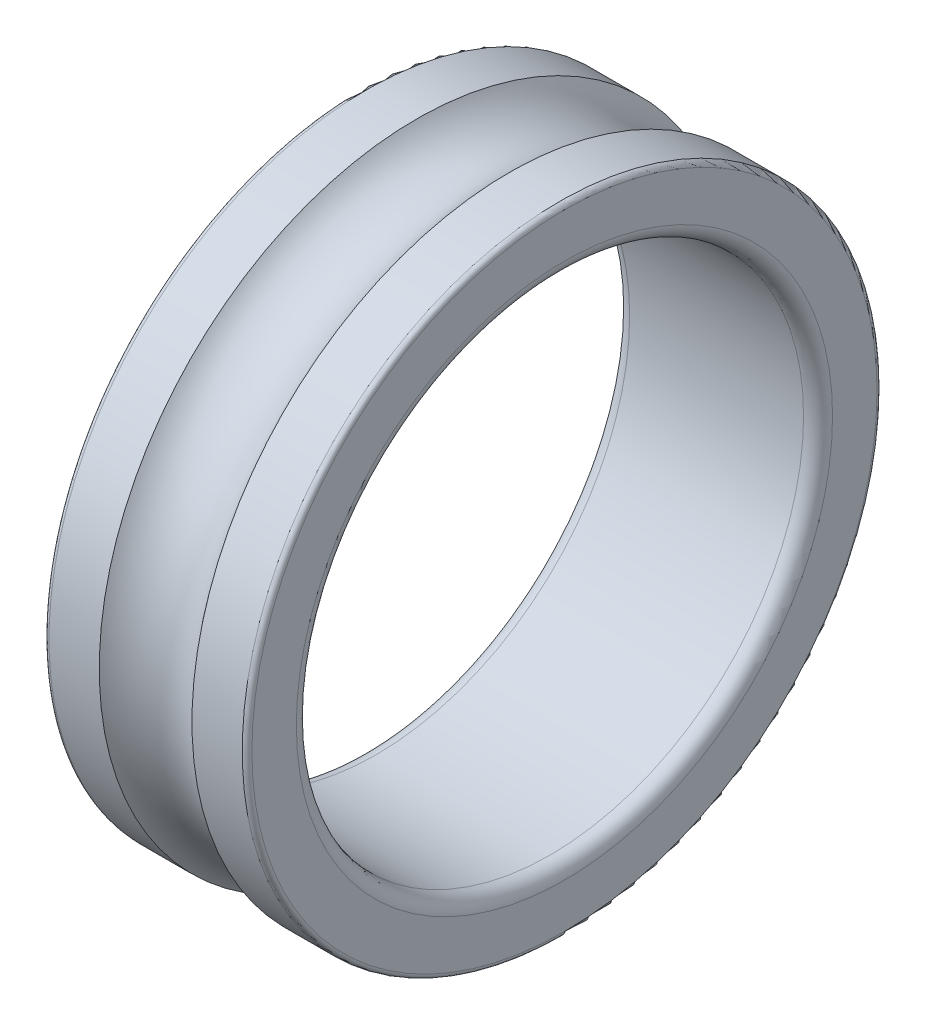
SolidWorks part; units mm, degrees
ref_plane "Plan de face" through (0, 0, 0) normal (0, 0, 1) x (1, 0, 0)
ref_plane "Plan de dessus" through (0, 0, 0) normal (0, 1, 0) x (1, 0, 0)
ref_plane "Plan de droite" through (0, 0, 0) normal (1, 0, 0) x (0, 0, -1)
ref_plane "Plan1" through (0, 0, 0) normal (0, 0, 1) x (1, 0, 0)
sketch "Esquisse1" plane through (0, 0, 0) normal (0, 0, 1) x (1, 0, 0)
  line L0 (1, 17.5) -> (13, 17.5)
  line L1 (14, 18.5) -> (14, 21.567)
  line L2 (13.667, 21.9) -> (10.1985, 21.9)
  line L3 (3.8015, 21.9) -> (0.333, 21.9)
  line L4 (0, 21.567) -> (0, 18.5)
  line L5 (13, 0) -> (1, 0) construction
  arc A0 (0, 18.5) -> (1, 17.5) centre (1, 18.5) ccw
  arc A1 (13, 17.5) -> (14, 18.5) centre (13, 18.5) ccw
  arc A2 (14, 21.567) -> (13.667, 21.9) centre (13.667, 21.567) ccw
  arc A3 (10.1985, 21.9) -> (3.8015, 21.9) centre (7, 24.25) cw
  arc A4 (0.333, 21.9) -> (0, 21.567) centre (0.333, 21.567) ccw
revolve "Révolution1" add sketch "Esquisse1" angle 360 about L5
